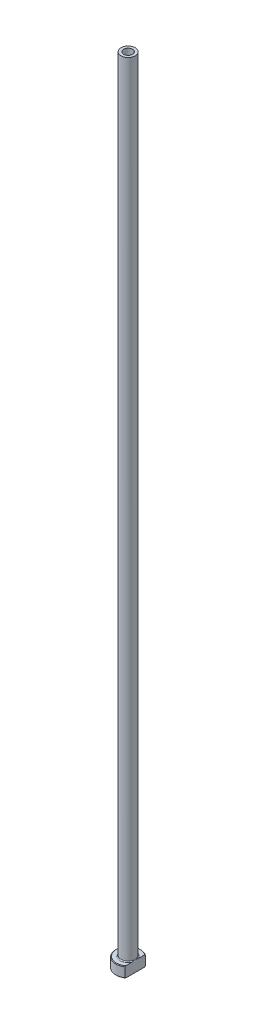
SolidWorks part; units mm, degrees
ref_plane "Front Plane" through (0, 0, 0) normal (0, 0, 1) x (1, 0, 0)
ref_plane "Top Plane" through (0, 0, 0) normal (0, 1, 0) x (1, 0, 0)
ref_plane "Right Plane" through (0, 0, 0) normal (1, 0, 0) x (0, 0, -1)
sketch "Sketch1" plane through (0, 0, 0) normal (0, 0, 1) x (1, 0, 0)
  line L0 (0, 0) -> (0, 50000) construction
  line L1 (0, 0) -> (5.5499, 0)
  line L2 (5.5499, 0) -> (5.5499, 4.7498)
  line L3 (5.5499, 4.7498) -> (3.5655, 4.7498)
  line L4 (3.1686, 5.1467) -> (3.1686, 355.6)
  line L5 (3.1686, 355.6) -> (0, 355.6)
  line L6 (0, 355.6) -> (0, 0)
  arc A0 (3.1686, 5.1467) -> (3.5655, 4.7498) centre (3.5655, 5.1467) ccw
  dimension "D5" = 0.3969
  dimension "D1" = 6.3373
  dimension "D2" = 11.0998
  dimension "D3" = 4.7498
  dimension "D4" = 355.6
revolve "Revolve1" add sketch "Sketch1" angle 360 about L0
sketch "Sketch2" plane through (0, 0, 0) normal (0, 0, 1) x (1, 0, 0)
  line L0 (0, 0) -> (0, 50000) construction
  line L1 (-5.5499, 0) -> (5.5499, 0) construction
  line L2 (2.5711, 0) -> (2.1742, 0.3969)
  line L3 (2.1742, 0.3969) -> (2.1742, 281.1145)
  line L4 (2.1742, 281.1145) -> (1.9837, 295.402)
  line L5 (1.9837, 295.402) -> (1.9837, 355.6)
  line L6 (3.1686, 355.6) -> (-3.1686, 355.6) construction
  line L7 (1.9837, 355.6) -> (0, 355.6)
  line L8 (0, 355.6) -> (0, 0)
  line L9 (0, 0) -> (2.5711, 0)
  point P4 (0, 0)
  dimension "D1" = 0.3969
  dimension "D2" = 45
  dimension "D3" = 3.9675
  dimension "D4" = 4.3485
  dimension "D5" = 60.198
  dimension "D6" = 14.2875
revolve "Cut-Revolve1" cut sketch "Sketch2" angle 360 about L0
chamfer "Chamfer1" distance 0.254 angle 45 2 edges at (0, 0, -5.5499) (0, 4.7498, -5.5499)
sketch "Sketch3" plane through (0, 0, 0) normal (0, -1, 0) x (1, 0, 0)
  line L0 (3.1686, 4.5564) -> (3.1687, -4.5564)
  circle A0 centre (0, 0) radius 3.1687 construction
  circle A1 centre (0, 0) radius 3.1687 construction
  arc A2 (3.1686, 4.5564) -> (3.1687, -4.5564) centre (0, 0) cw
  circle A3 centre (0, 0) radius 5.5499 construction
extrude "Cut-Extrude1" cut sketch "Sketch3" against normal up to next contours A2 L0
